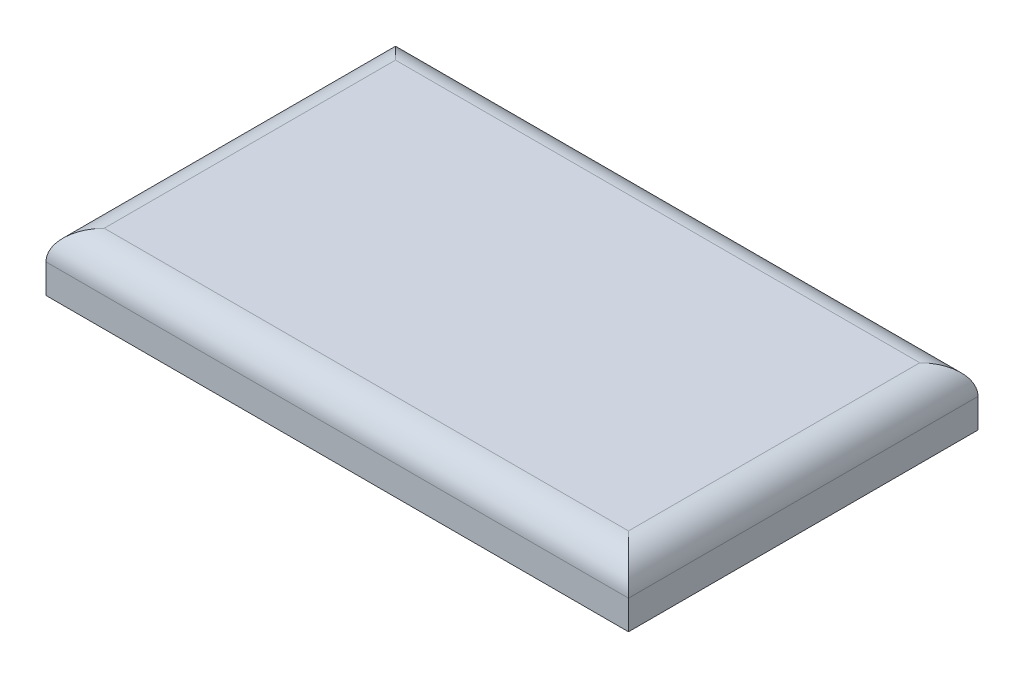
SolidWorks part; units mm, degrees
ref_plane "Front Plane" through (0, 0, 0) normal (0, 0, 1) x (1, 0, 0)
ref_plane "Top Plane" through (0, 0, 0) normal (0, 1, 0) x (1, 0, 0)
ref_plane "Right Plane" through (0, 0, 0) normal (1, 0, 0) x (0, 0, -1)
sketch "Sketch1" plane through (0, 0, 0) normal (0, 1, 0) x (1, 0, 0)
  line L1 (-50, -30) -> (50, -30)
  line L2 (-50, -30) -> (-50, 30)
  line L3 (-50, 30) -> (50, 30)
  line L4 (50, -30) -> (50, 30)
  line L5 (-50, -30) -> (50, 30) construction
  line L6 (-50, 30) -> (50, -30) construction
  point P0 (0, 0)
  dimension "D1" = 100
  dimension "D2" = 60
extrude "Extrude1" add sketch "Sketch1" along normal blind 10
fillet "Fillet1" radius 5 4 edges at (0, 10, 30) (-50, 10, 0) (0, 10, -30) (50, 10, 0)
